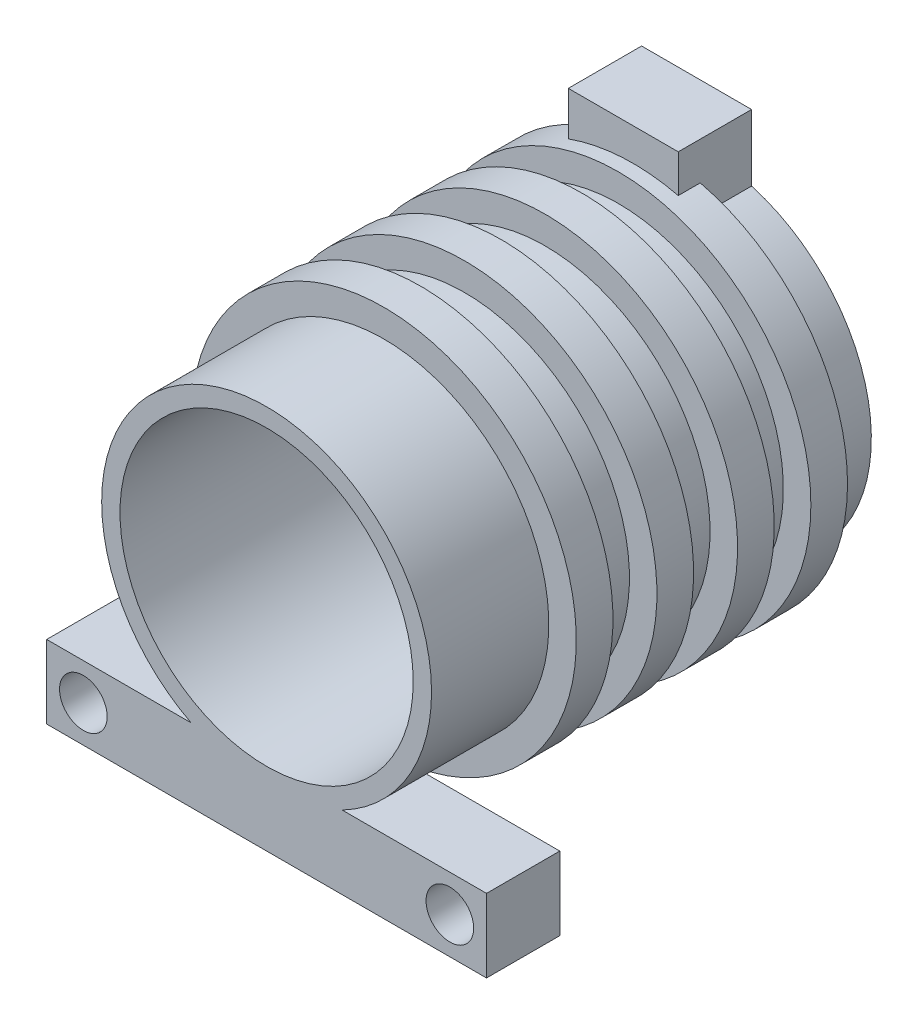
SolidWorks part; units mm, degrees
ref_plane "Front Plane" through (0, 0, 0) normal (0, 0, 1) x (1, 0, 0)
ref_plane "Top Plane" through (0, 0, 0) normal (0, 1, 0) x (1, 0, 0)
ref_plane "Right Plane" through (0, 0, 0) normal (1, 0, 0) x (0, 0, -1)
sketch "Sketch2" plane through (0, 0, 0) normal (0, 0, 1) x (1, 0, 0)
  circle A0 centre (0, 0) radius 57.15
  dimension "D1" = 114.3
extrude "Boss-Extrude1" add sketch "Sketch2" along normal blind 152.4
sketch "Sketch3" plane through (0, 0, 152.4) normal (0, 0, 1) x (1, 0, 0)
  circle A0 centre (0, 0) radius 50.8
  dimension "D1" = 101.6
extrude "Cut-Extrude1" cut sketch "Sketch3" against normal blind 152.4
sketch "Sketch34" plane through (0, 0, 152.4) normal (0, 0, 1) x (1, 0, 0)
  line L0 (-76.2, -50.8) -> (76.2, -50.8)
  line L1 (-76.2, -50.8) -> (-76.2, -76.2)
  line L2 (76.2, -50.8) -> (76.2, -76.2)
  line L3 (-76.2, -76.2) -> (76.2, -76.2)
  circle A0 centre (0, 0) radius 50.8 construction
  point P6 (-76.2, -63.5)
  dimension "D1" = 50.8
  dimension "D2" = 152.4
  dimension "D3" = 76.2
  dimension "D4" = 25.4
extrude "Boss-Extrude3" add sketch "Sketch34" against normal blind 25.4
sketch "Sketch35" plane through (0, 0, 152.4) normal (0, 0, 1) x (1, 0, 0)
  line L0 (-76.2, -50.8) -> (-76.2, -76.2) construction
  circle A0 centre (-63.5, -63.5) radius 8.255
  circle A1 centre (63.5, -63.5) radius 8.255
  dimension "D1" = 16.51
  dimension "D2" = 16.51
  dimension "D3" = 127
  dimension "D4" = 12.7
extrude "Cut-Extrude2" cut sketch "Sketch35" against normal blind 30.48
sketch "Sketch37" plane through (0, 0, 0) normal (0, 0, -1) x (-1, 0, 0)
  circle A0 centre (0, 0) radius 66.675
  circle A1 centre (0, 0) radius 57.15
  dimension "D1" = 133.35
extrude "Boss-Extrude4" add sketch "Sketch37" against normal blind 12.7 from offset 99.06
sketch "Sketch38" plane through (0, 0, 0) normal (0, 0, -1) x (-1, 0, 0)
  circle A0 centre (0, 0) radius 66.675
  circle A1 centre (0, 0) radius 57.15
extrude "Boss-Extrude5" add sketch "Sketch38" along normal blind 12.7 from offset 83.82
sketch "Sketch39" plane through (0, 0, 0) normal (0, 0, -1) x (-1, 0, 0)
  circle A0 centre (0, 0) radius 66.675
  circle A1 centre (0, 0) radius 57.15
extrude "Boss-Extrude6" add sketch "Sketch39" along normal blind 12.7 from offset 55.88
sketch "Sketch40" plane through (0, 0, 0) normal (0, 0, -1) x (-1, 0, 0)
  circle A0 centre (0, 0) radius 66.675
  circle A1 centre (0, 0) radius 57.15
extrude "Boss-Extrude7" add sketch "Sketch40" along normal blind 12.7 from offset 30.48
sketch "Sketch4" plane through (0, 0, 0) normal (0, 0, -1) x (-1, 0, 0)
  line L0 (-15.6453, 54.9668) -> (-15.6453, 77.9539)
  line L1 (-15.6453, 77.9539) -> (22.4547, 77.9539)
  line L2 (22.4547, 77.9539) -> (22.4547, 52.5539)
  arc A0 (-15.6453, 54.9668) -> (22.4547, 52.5539) centre (0, 0) cw
  circle A1 centre (0, 0) radius 57.15 construction
  dimension "D1" = 25.4
  dimension "D2" = 38.1
extrude "Boss-Extrude2" add sketch "Sketch4" against normal blind 25.4
